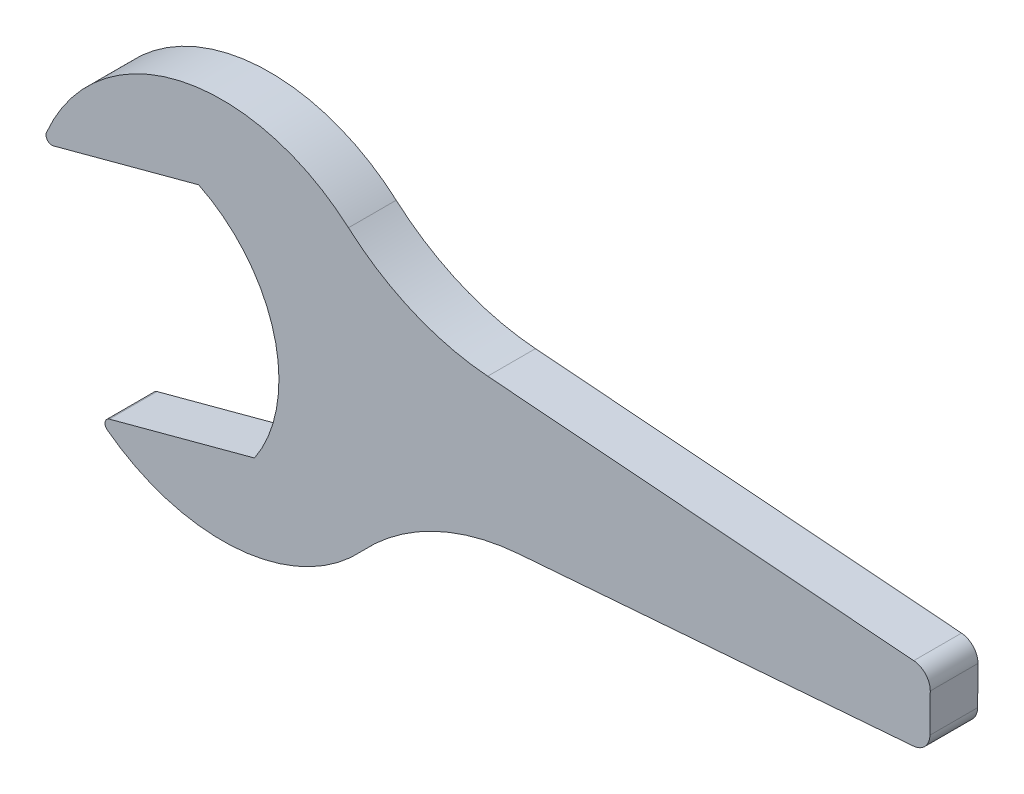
SolidWorks part; units mm, degrees
ref_plane "Front Plane" through (0, 0, 0) normal (0, 0, 1) x (1, 0, 0)
ref_plane "Top Plane" through (0, 0, 0) normal (0, 1, 0) x (1, 0, 0)
ref_plane "Right Plane" through (0, 0, 0) normal (1, 0, 0) x (0, 0, -1)
sketch "Sketch1" plane through (0, 0, 0) normal (0, 0, 1) x (1, 0, 0)
  line L0 (0, 0) -> (845.8187, 0) construction
  line L1 (0, 0) -> (-180.5092, -48.3673) construction
  line L2 (-109.3808, -248.615) -> (-219.034, 160.6165) construction
  line L3 (-194.3398, 41.6193) -> (-63.2174, 76.7535)
  line L4 (-147.4936, -133.2133) -> (-16.3711, -98.0791)
  line L5 (96.7492, 65.4213) -> (550, 29.9775)
  line L6 (549.4256, -30.0225) -> (107.5241, -64.5787)
  line L7 (550, 29.9775) -> (549.4256, -30.0225)
  arc A0 (-147.4936, -133.2133) -> (107.5241, -64.5787) centre (-43.4667, -11.6469) ccw
  circle A1 centre (-115.9111, -31.0583) radius 120 construction
  arc A2 (-63.2174, 76.7535) -> (-16.3711, -98.0791) centre (-115.9111, -31.0583) cw
  arc A3 (96.7492, 65.4213) -> (-194.3398, 41.6193) centre (-43.4667, -11.6469) ccw
  point P4 (-43.4667, -11.6469)
  point P8 (-164.2074, -43.9992)
  point P13 (-164.2074, -43.9992)
  dimension "D3" = 320
  dimension "D4" = 240
  dimension "D7" = 550
  dimension "D1" = 15
  dimension "D2" = 45
  dimension "D5" = 125
  dimension "D6" = 90.5
  dimension "D8" = 130
  dimension "D9" = 60
extrude "Boss-Extrude1" add sketch "Sketch1" along normal blind 40
fillet "Fillet1" radius 5 2 edges at (-147.4936, -133.2133, 20) (-194.3398, 41.6193, 20)
fillet "Fillet2" radius 200 2 edges at (107.5241, -64.5787, 20) (96.7492, 65.4213, 20)
fillet "Fillet3" radius 15 2 edges at (550, 29.9775, 20) (549.4256, -30.0225, 20)
